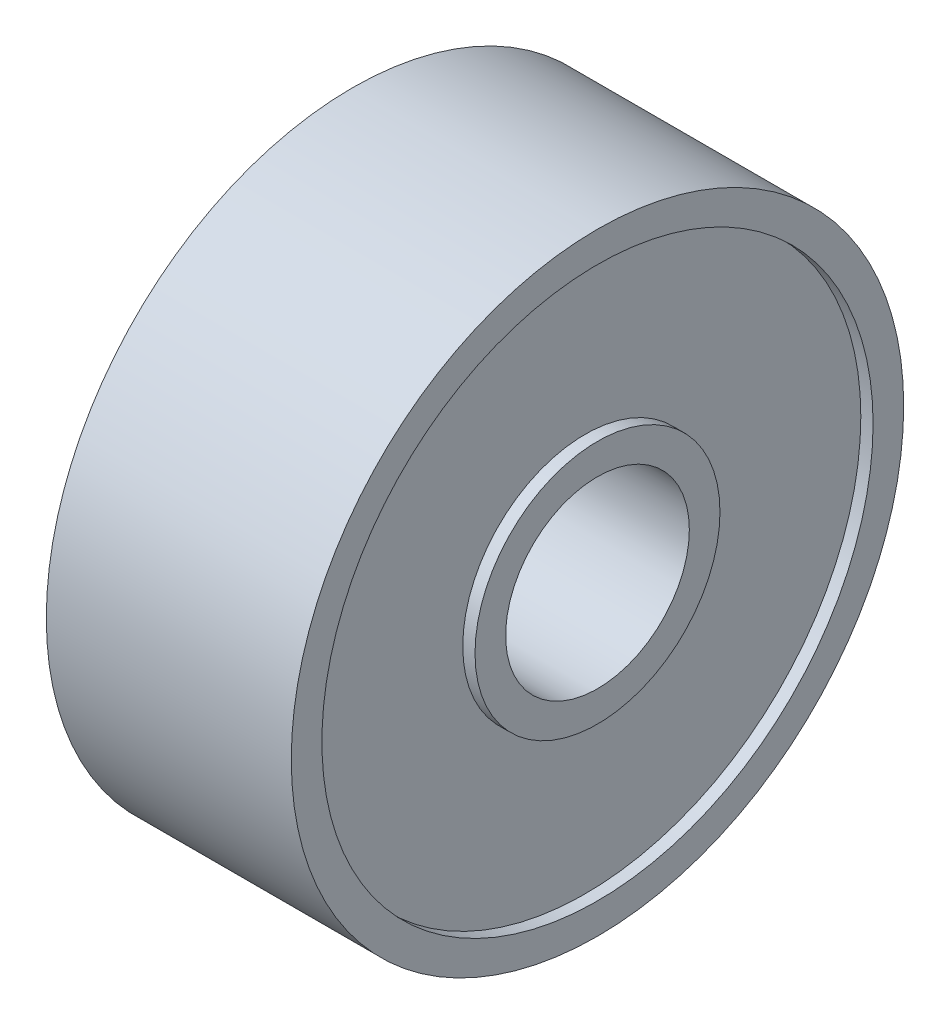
SolidWorks part; units mm, degrees
ref_plane "Plan de face" through (0, 0, 0) normal (0, 0, 1) x (1, 0, 0)
ref_plane "Plan de dessus" through (0, 0, 0) normal (0, 1, 0) x (1, 0, 0)
ref_plane "Plan de droite" through (0, 0, 0) normal (1, 0, 0) x (0, 0, -1)
sketch "Esquisse1" plane through (0, 0, 0) normal (1, 0, 0) x (0, 0, -1)
  circle A0 centre (0, 0) radius 5
  circle A1 centre (0, 0) radius 1.5
extrude "Boss.-Extru.1" add sketch "Esquisse1" along normal blind 4
sketch "Esquisse2" plane through (4, 0, 0) normal (1, 0, 0) x (0, 0, -1)
  circle A0 centre (0, 0) radius 2
  circle A1 centre (0, 0) radius 4.5
extrude "Enlèv. mat.-Extru.1" cut sketch "Esquisse2" against normal blind 0.2
sketch "Esquisse3" plane through (0, 0, 0) normal (-1, 0, 0) x (0, 0, 1)
  circle A0 centre (0, 0) radius 2
  circle A1 centre (0, 0) radius 4.5
extrude "Enlèv. mat.-Extru.2" cut sketch "Esquisse3" against normal blind 0.2
